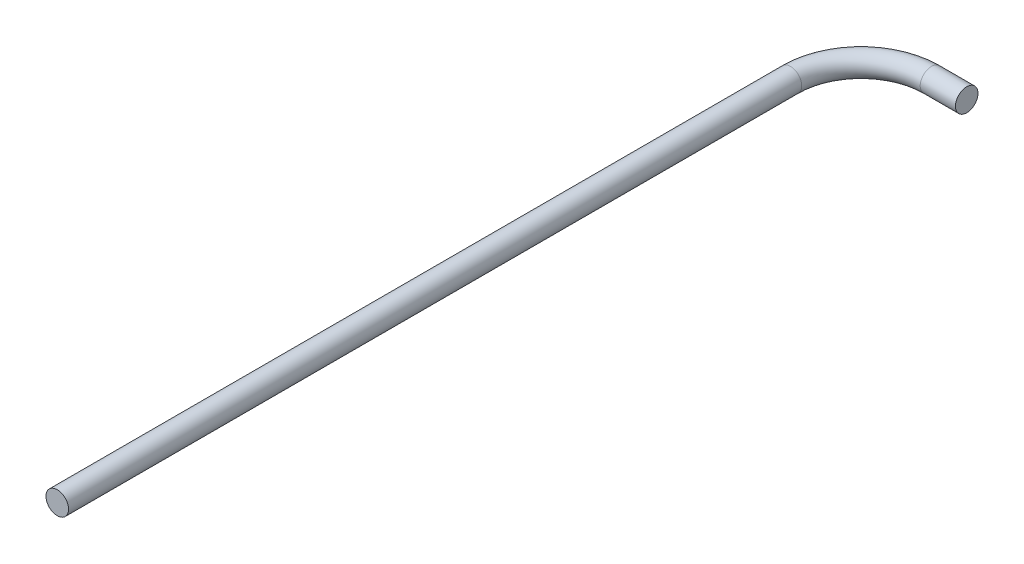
SolidWorks part; units mm, degrees
ref_plane "Front Plane" through (0, 0, 0) normal (0, 0, 1) x (1, 0, 0)
ref_plane "Top Plane" through (0, 0, 0) normal (0, 1, 0) x (1, 0, 0)
ref_plane "Right Plane" through (0, 0, 0) normal (1, 0, 0) x (0, 0, -1)
sketch "Sketch1" plane through (0, 0, 0) normal (0, 0, 1) x (1, 0, 0)
  circle A0 centre (0, 0) radius 0.8
  dimension "D1" = 1.6
sketch "Sketch2" plane through (0, 0, 0) normal (0, 1, 0) x (1, 0, 0)
  line L0 (0, 0) -> (0, 52)
  line L1 (5, 57) -> (7.5, 57)
  arc A0 (0, 52) -> (5, 57) centre (5, 52) cw
  point P6 (0, 57)
  dimension "D3" = 5
  dimension "D1" = 57
  dimension "D2" = 7.5
sweep "Sweep1" add profiles "Sketch1" path "Sketch2"
